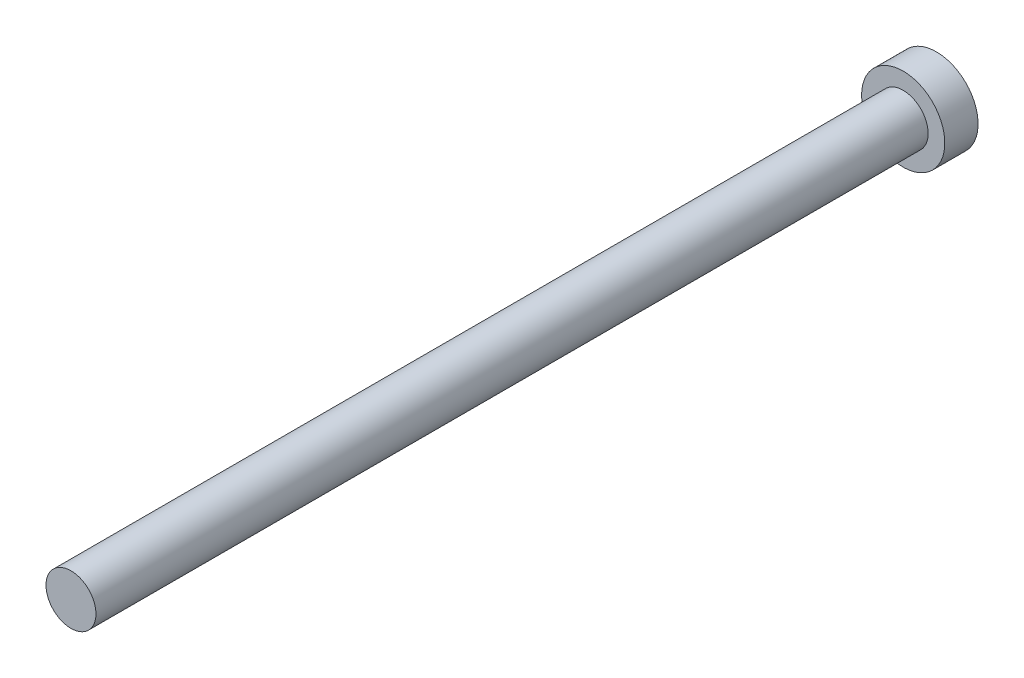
SolidWorks part; units mm, degrees
ref_plane "正面" through (0, 0, 0) normal (0, 0, 1) x (1, 0, 0)
ref_plane "平面" through (0, 0, 0) normal (0, 1, 0) x (1, 0, 0)
ref_plane "右側面" through (0, 0, 0) normal (1, 0, 0) x (0, 0, -1)
sketch "ｽｹｯﾁ1" plane through (0, 0, 0) normal (0, 0, 1) x (1, 0, 0)
  circle A0 centre (0, 0) radius 1.5
  dimension "D1" = 3
extrude "押し出し1" add sketch "ｽｹｯﾁ1" along normal blind 50
sketch "ｽｹｯﾁ2" plane through (0, 0, 0) normal (0, 0, -1) x (-1, 0, 0)
  circle A0 centre (0, 0) radius 2.5
  dimension "D1" = 5
extrude "押し出し2" add sketch "ｽｹｯﾁ2" along normal blind 2
